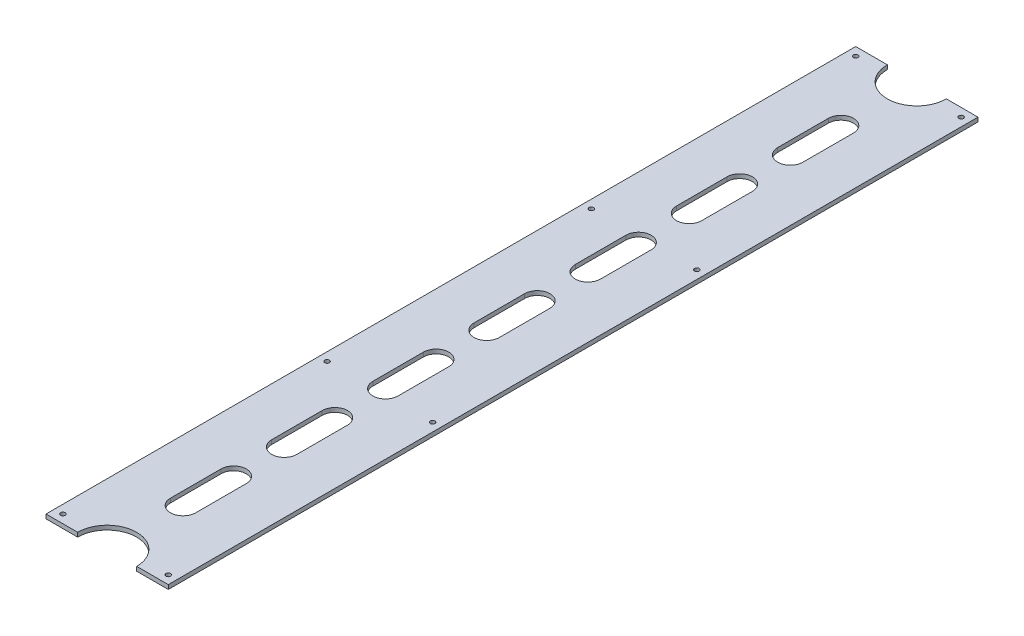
SolidWorks part; units mm, degrees
ref_plane "Front Plane" through (0, 0, 0) normal (0, 0, 1) x (1, 0, 0)
ref_plane "Top Plane" through (0, 0, 0) normal (0, 1, 0) x (1, 0, 0)
ref_plane "Right Plane" through (0, 0, 0) normal (1, 0, 0) x (0, 0, -1)
sketch "Sketch1" plane through (0, 0, 0) normal (0, 1, 0) x (1, 0, 0)
  line L1 (-92.075, 609.6) -> (92.075, 609.6)
  line L2 (-92.075, 609.6) -> (-92.075, -609.6)
  line L3 (-92.075, -609.6) -> (92.075, -609.6)
  line L4 (92.075, 609.6) -> (92.075, -609.6)
  line L5 (-92.075, 609.6) -> (92.075, -609.6) construction
  line L6 (-92.075, -609.6) -> (92.075, 609.6) construction
  point P0 (0, 0)
  dimension "D1" = 184.15
  dimension "D2" = 1219.2
sheet metal parameters "Sheet-Metal1" thickness 6.35 parameters "D1"=6.35
base flange "Base-Flange1" sketch "Sketch1" thickness 6.35 reverse thickness direction no parameters "D1"=6.35
sketch "Sketch4" plane through (0, 0, 0) normal (0, 1, 0) x (1, 0, 0)
  line L0 (92.075, 609.6) -> (-92.075, 609.6) construction
  line L1 (-92.075, 609.6) -> (-92.075, -609.6) construction
  line L2 (92.075, -609.6) -> (92.075, 609.6) construction
  circle A0 centre (-79.375, 596.9) radius 3.4925
  circle A1 centre (79.375, 596.9) radius 3.4925
  dimension "D1" = 12.7
  dimension "D3" = 6.985
  dimension "D4" = 12.7
  dimension "D6" = 6.985
  dimension "D2" = 12.7
  dimension "D5" = 12.7
extrude "Cut-Extrude1" cut sketch "Sketch4" against normal through all
pattern_linear "LPattern1" count 4 spacing 397.9316 along (0, 0, 1) of "Cut-Extrude1"
sketch "Sketch5" plane through (0, 0, 0) normal (0, 1, 0) x (1, 0, 0)
  line L0 (92.075, 609.6) -> (-92.075, 609.6) construction
  line L1 (-92.075, -609.6) -> (92.075, -609.6) construction
  circle A0 centre (0, 609.6) radius 44.45
  circle A1 centre (0, -609.6) radius 44.45
  dimension "D1" = 88.9
  dimension "D2" = 88.9
extrude "Cut-Extrude2" cut sketch "Sketch5" against normal through all
sketch "Sketch6" plane through (0, 0, 0) normal (0, 1, 0) x (1, 0, 0)
  line L0 (0, 495.3) -> (0, 419.1) construction
  line L1 (19.05, 495.3) -> (19.05, 419.1)
  line L2 (-19.05, 495.3) -> (-19.05, 419.1)
  line L3 (-44.45, 609.6) -> (-92.075, 609.6) construction
  arc A0 (19.05, 495.3) -> (-19.05, 495.3) centre (0, 495.3) ccw
  arc A1 (-19.05, 419.1) -> (19.05, 419.1) centre (0, 419.1) ccw
  point P2 (0, 457.2)
  dimension "D1" = 76.2
  dimension "D2" = 38.1
  dimension "D3" = 114.3
extrude "Cut-Extrude3" cut sketch "Sketch6" against normal through all
pattern_linear "LPattern2" count 7 spacing 152.4 along (0, 0, 1) of "Cut-Extrude3"
flat pattern "Flat-Pattern1"
sketch "Bend-Lines1" plane through (0, 0, 0) normal (0, 1, 0) x (1, 0, 0)
sketch3d "Bounding-Box1" [suppressed]
  line L0 (-92.075, 609.6, 0) -> (-92.075, -609.6, 0) construction
  line L1 (92.075, 609.6, 0) -> (92.075, -609.6, 0) construction
  line L2 (-92.075, 609.6, 0) -> (92.075, 609.6, 0) construction
  line L3 (-92.075, -609.6, 0) -> (92.075, -609.6, 0) construction
